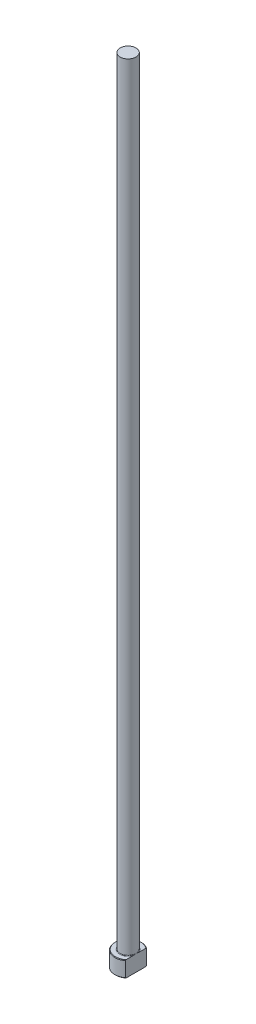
SolidWorks part; units mm, degrees
ref_plane "Front Plane" through (0, 0, 0) normal (0, 0, 1) x (1, 0, 0)
ref_plane "Top Plane" through (0, 0, 0) normal (0, 1, 0) x (1, 0, 0)
ref_plane "Right Plane" through (0, 0, 0) normal (1, 0, 0) x (0, 0, -1)
sketch "Sketch1" plane through (0, 0, 0) normal (0, 0, 1) x (1, 0, 0)
  line L0 (0, 259.9588) -> (0, -15.1925) construction
  line L1 (0, 0) -> (-5, 0)
  line L2 (-5, 0) -> (-5, 6)
  line L3 (-5, 6) -> (-3, 6)
  line L4 (-3, 6) -> (-3, 300)
  line L5 (-3, 300) -> (0, 300)
  line L6 (0, 300) -> (0, 0)
  dimension "L" = 300
  dimension "H" = 10
  dimension "T" = 6
  dimension "D" = 6
revolve "Revolve1" add sketch "Sketch1" angle 360 about L0
chamfer "Chamfer1" distance 0.2 angle 45 2 edges at (0, 6, 5) (0, 0, 5)
fillet "Fillet1" radius 0.2 1 edges at (0, 6, 3)
sketch "Sketch2" plane through (0, 0, 0) normal (0, 1, 0) x (1, 0, 0)
  line L0 (3, -4) -> (3, 4)
  circle A0 centre (0, 0) radius 5 construction
  arc A1 (3, -4) -> (3, 4) centre (0, 0) ccw
  circle A2 centre (0, 0) radius 3 construction
extrude "KEYED HEAD" cut sketch "Sketch2" along normal through all
